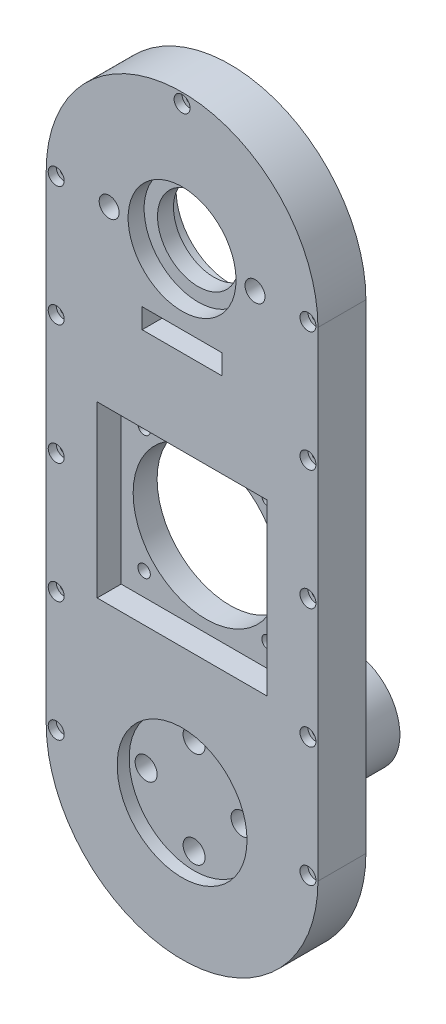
SolidWorks part; units mm, degrees
ref_plane "Front Plane" through (0, 0, 0) normal (0, 0, 1) x (1, 0, 0)
ref_plane "Top Plane" through (0, 0, 0) normal (0, 1, 0) x (1, 0, 0)
ref_plane "Right Plane" through (0, 0, 0) normal (1, 0, 0) x (0, 0, -1)
sketch "Sketch1" plane through (0, 0, 0) normal (0, 0, 1) x (1, 0, 0)
  line L2 (-34, -60) -> (-34, 60)
  line L4 (34, -60) -> (34, 60)
  line L5 (-34, -60) -> (34, 60) construction
  line L6 (-34, 60) -> (34, -60) construction
  arc A0 (34, -60) -> (-34, -60) centre (0, -60) cw
  arc A1 (-34, 60) -> (34, 60) centre (0, 60) cw
  point P0 (0, 0)
  dimension "D1" = 120
  dimension "D2" = 68
extrude "Boss-Extrude1" add sketch "Sketch1" along normal blind 12
sketch "Sketch2" plane through (0, 0, 12) normal (0, 0, 1) x (1, 0, 0)
  arc A0 (-34, -60) -> (34, -60) centre (0, -60) ccw construction
  arc A1 (-34, -60) -> (34, -60) centre (0, -60) ccw construction
  circle A2 centre (0, -60) radius 16.25
  dimension "D1" = 32.5
extrude "Cut-Extrude1" cut sketch "Sketch2" against normal blind 3
sketch "Sketch3" plane through (0, 0, 9) normal (0, 0, 1) x (1, 0, 0)
  circle A0 centre (0, -48) radius 2.75
  circle A1 centre (0, -60) radius 16.25
  circle A2 centre (0, -60) radius 16.25 construction
  circle A3 centre (12, -60) radius 2.75
  circle A4 centre (0, -72) radius 2.75
  circle A5 centre (-12, -60) radius 2.75
  point P14 (0, -60)
  dimension "D2" = 5.5
  dimension "D3" = 12
  dimension "D1" = 0
  dimension "D4" = 4
extrude "Cut-Extrude2" cut sketch "Sketch3" against normal blind 5
sketch "Sketch4" plane through (0, 0, 0) normal (0, 0, -1) x (-1, 0, 0)
  arc A0 (-34, -60) -> (34, -60) centre (0, -60) ccw construction
  arc A1 (-34, -60) -> (34, -60) centre (0, -60) ccw construction
  circle A2 centre (0, -60) radius 12.5
  dimension "D1" = 25
extrude "Boss-Extrude2" add sketch "Sketch4" along normal blind 30
sketch "Sketch12" plane through (0, 0, 12) normal (0, 0, 1) x (1, 0, 0)
  line L0 (0, 0) -> (0, -5) construction
  line L1 (-15.5, -20.5) -> (15.5, -20.5) construction
  line L2 (-15.5, -20.5) -> (-15.5, 10.5) construction
  line L3 (-15.5, 10.5) -> (15.5, 10.5) construction
  line L4 (15.5, -20.5) -> (15.5, 10.5) construction
  line L5 (-15.5, -20.5) -> (15.5, 10.5) construction
  line L6 (-15.5, 10.5) -> (15.5, -20.5) construction
  circle A8 centre (-15.5, 10.5) radius 1.55
  circle A9 centre (15.5, 10.5) radius 1.55
  circle A10 centre (15.5, -20.5) radius 1.55
  circle A11 centre (-15.5, -20.5) radius 1.55
  circle A12 centre (0, -5) radius 18.25
  point P0 (0, -5)
  point P18 (0, -5)
  dimension "D3" = 3.1
  dimension "D5" = 36.5
  dimension "D1" = 31
  dimension "D2" = 5
  dimension "D4" = 4
extrude "Cut-Extrude9" cut sketch "Sketch12" against normal up to next
sketch "Sketch13" plane through (0, 0, 0) normal (0, 0, -1) x (-1, 0, 0)
  line L0 (0, 0) -> (0, -5) construction
  line L1 (-15.5, -20.5) -> (15.5, -20.5) construction
  line L2 (-15.5, -20.5) -> (-15.5, 10.5) construction
  line L3 (-15.5, 10.5) -> (15.5, 10.5) construction
  line L4 (15.5, -20.5) -> (15.5, 10.5) construction
  line L5 (-15.5, -20.5) -> (15.5, 10.5) construction
  line L6 (-15.5, 10.5) -> (15.5, -20.5) construction
  circle A8 centre (15.5, 10.5) radius 3
  circle A9 centre (15.5, -20.5) radius 3
  circle A10 centre (-15.5, -20.5) radius 3
  circle A11 centre (-15.5, 10.5) radius 3
  circle A12 centre (0, -5) radius 18.25 construction
  circle A13 centre (0, -5) radius 18.25 construction
  point P0 (0, -5)
  point P17 (0, -5)
  dimension "D2" = 5
  dimension "D3" = 6
  dimension "D1" = 31
  dimension "D4" = 4
extrude "Cut-Extrude10" cut sketch "Sketch13" against normal blind 3
sketch "Sketch14" plane through (0, 0, 12) normal (0, 0, 1) x (1, 0, 0)
  arc A0 (34, 60) -> (-34, 60) centre (0, 60) ccw construction
  arc A1 (34, 60) -> (-34, 60) centre (0, 60) ccw construction
  circle A2 centre (0, 60) radius 10.15
  dimension "D1" = 20.3
extrude "Cut-Extrude11" cut sketch "Sketch14" against normal up to next
sketch "Sketch15" plane through (0, 0, 12) normal (0, 0, 1) x (1, 0, 0)
  circle A0 centre (0, 60) radius 10.15 construction
  circle A1 centre (0, 60) radius 10.15 construction
  circle A2 centre (0, 60) radius 13.5
  dimension "D1" = 27
extrude "Cut-Extrude12" cut sketch "Sketch15" against normal blind 4
ref_plane "Plane1" through (0, 0, 6) normal (0, 0, 1) x (1, 0, 0)
mirror "Mirror1" about plane through (0, 0, 6) normal (0, 0, 1) of "Cut-Extrude12"
sketch "Sketch19" plane through (0, 0, 12) normal (0, 0, 1) x (1, 0, 0)
  line L0 (31.5, 60) -> (-31.5, 60) construction
  line L1 (0, 60) -> (0, 0) construction
  line L2 (-31.5, 60) -> (-31.5, -58.8117) construction
  line L3 (31.5, 60) -> (31.5, -58.8117) construction
  line L4 (0, 60) -> (0, 91.5) construction
  arc A0 (31.5, 60) -> (-31.5, 60) centre (0, 60) ccw construction
  circle A1 centre (0, 91.5) radius 1
  circle A2 centre (-31.5, 60) radius 1
  circle A3 centre (31.5, 60) radius 1
  circle A4 centre (31.5, 30) radius 1
  circle A5 centre (31.5, 0) radius 1
  circle A6 centre (31.5, -30) radius 1
  circle A9 centre (-31.5, 30) radius 1
  circle A10 centre (-31.5, 0) radius 1
  circle A11 centre (-31.5, -30) radius 1
  point P6 (0, 60)
  dimension "D1" = 63
  dimension "D2" = 2
  dimension "D3" = 2
  dimension "D4" = 2
  dimension "D5" = 4
extrude "Cut-Extrude17" cut sketch "Sketch19" against normal up to next
sketch "Sketch20" plane through (0, 0, 0) normal (0, 0, 1) x (1, 0, 0)
  line L0 (31.5, 60) -> (-31.5, 60) construction
  line L1 (0, 0) -> (0, 60) construction
  line L2 (-31.5, 60) -> (-31.5, -60.6771) construction
  line L3 (31.5, 60) -> (31.5, -60.6771) construction
  line L4 (0, 60) -> (0, 91.5) construction
  arc A0 (31.5, 60) -> (-31.5, 60) centre (0, 60) ccw construction
  circle A1 centre (0, 91.5) radius 2
  circle A2 centre (-31.5, 60) radius 2
  circle A3 centre (31.5, 60) radius 2
  circle A4 centre (31.5, 30) radius 2
  circle A5 centre (31.5, 0) radius 2
  circle A6 centre (31.5, -30) radius 2
  circle A7 centre (31.5, -60) radius 2
  circle A9 centre (-31.5, 30) radius 2
  circle A10 centre (-31.5, 0) radius 2
  circle A11 centre (-31.5, -30) radius 2
  circle A12 centre (-31.5, -60) radius 2
  circle A13 centre (0, 60) radius 13.5 construction
  circle A14 centre (0, 60) radius 13.5 construction
  dimension "D1" = 63
  dimension "D2" = 4
  dimension "D3" = 4
  dimension "D4" = 2
  dimension "D5" = 5
  dimension "D6" = 60
extrude "Cut-Extrude18" cut sketch "Sketch20" against normal blind 2 from surface at 12
sketch "Sketch21" plane through (0, 0, 12) normal (0, 0, 1) x (1, 0, 0)
  line L0 (18.25, 60) -> (-18.25, 60) construction
  circle A0 centre (0, 60) radius 13.5 construction
  circle A1 centre (0, 60) radius 13.5 construction
  circle A2 centre (-18.25, 60) radius 2.5
  circle A3 centre (18.25, 60) radius 2.5
  point P6 (0, 60)
  dimension "D2" = 5
  dimension "D3" = 5
  dimension "D1" = 36.5
extrude "Cut-Extrude19" cut sketch "Sketch21" against normal up to next
sketch "Sketch22" plane through (0, 0, 12) normal (0, 0, 1) x (1, 0, 0)
  line L1 (-21.25, -26.25) -> (21.25, -26.25)
  line L2 (-21.25, -26.25) -> (-21.25, 16.25)
  line L3 (-21.25, 16.25) -> (21.25, 16.25)
  line L4 (21.25, -26.25) -> (21.25, 16.25)
  line L5 (-21.25, -26.25) -> (21.25, 16.25) construction
  line L6 (-21.25, 16.25) -> (21.25, -26.25) construction
  circle A0 centre (0, -5) radius 18.25 construction
  circle A1 centre (0, -5) radius 18.25 construction
  dimension "D1" = 42.5
extrude "Cut-Extrude20" cut sketch "Sketch22" against normal blind 6
sketch "Sketch23" plane through (0, 0, 0) normal (0, 0, -1) x (-1, 0, 0)
  line L0 (0, 0) -> (0, 40) construction
  line L6 (-10, 37.5) -> (10, 37.5)
  line L7 (-10, 37.5) -> (-10, 42.5)
  line L8 (-10, 42.5) -> (10, 42.5)
  line L9 (10, 37.5) -> (10, 42.5)
  line L10 (-10, 37.5) -> (10, 42.5) construction
  line L11 (-10, 42.5) -> (10, 37.5) construction
  dimension "D1" = 5
  dimension "D2" = 20
  dimension "D3" = 40
extrude "Cut-Extrude21" cut sketch "Sketch23" against normal up to next
